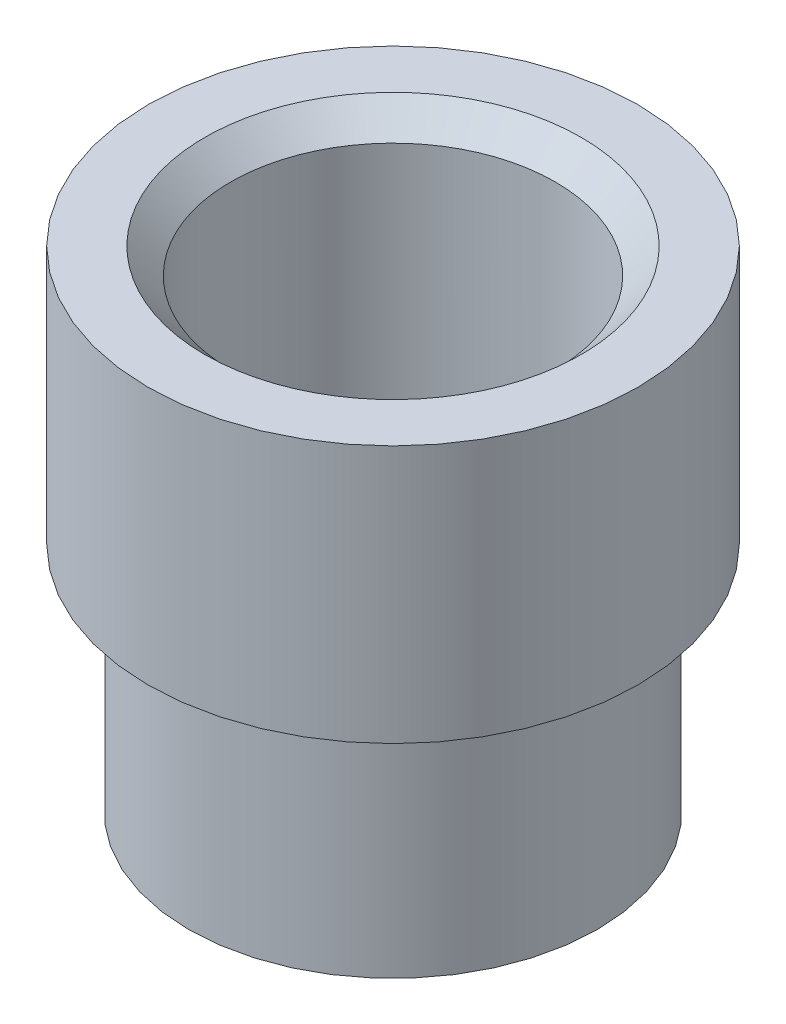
SolidWorks part; units mm, degrees
other "inverted_pendulum_nx_objects[1]"
ref_plane "Front Plane" through (0, 0, 0) normal (0, 0, 1) x (1, 0, 0)
ref_plane "Top Plane" through (0, 0, 0) normal (0, 1, 0) x (1, 0, 0)
ref_plane "Right Plane" through (0, 0, 0) normal (1, 0, 0) x (0, 0, -1)
imported_body "magnet-cap.stp<1>"
move or copy body "Body-Move/Copy1" bodies to move or copy 101 placed by mates yes parameters "D1"=0, "D2"=0, "D3"=0
